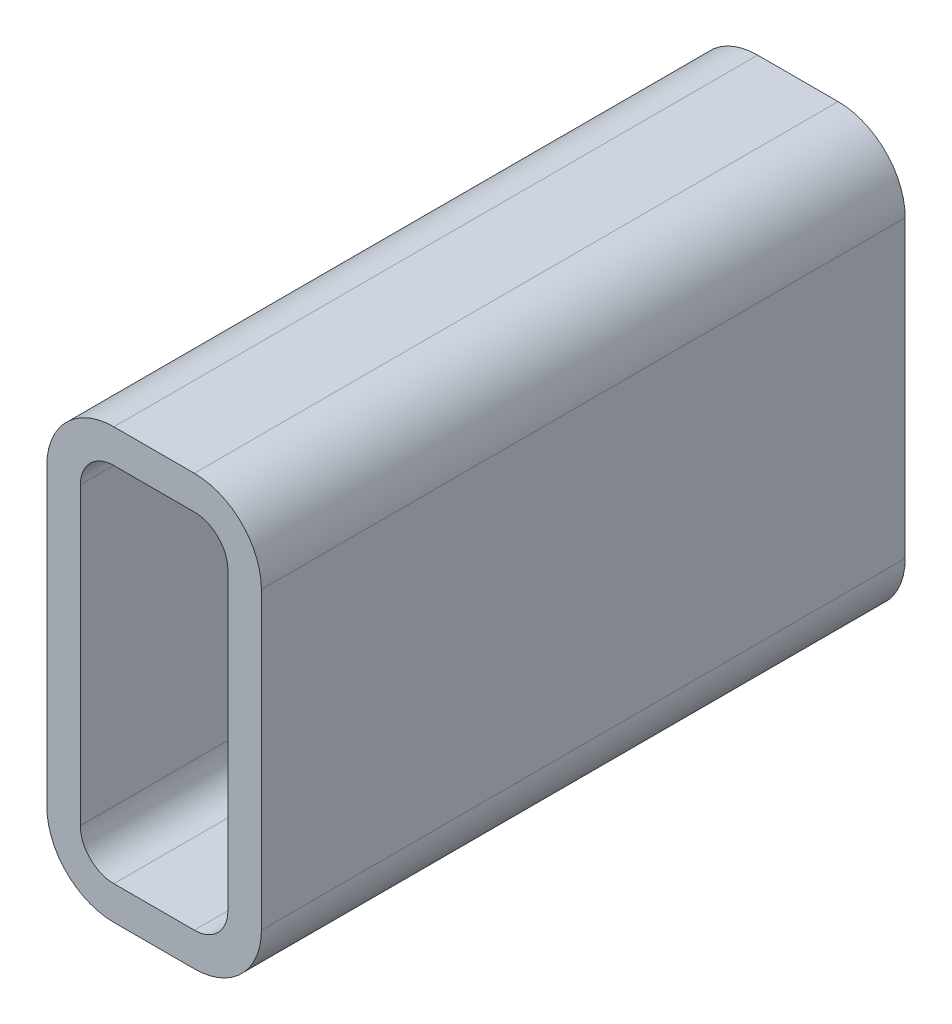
SolidWorks part; units mm, degrees
ref_plane "Front Plane" through (0, 0, 0) normal (0, 0, 1) x (1, 0, 0)
ref_plane "Top Plane" through (0, 0, 0) normal (0, 1, 0) x (1, 0, 0)
ref_plane "Right Plane" through (0, 0, 0) normal (1, 0, 0) x (0, 0, -1)
sketch "Sketch1" plane through (0, 0, 0) normal (0, 0, 1) x (1, 0, 0)
sketch_block_instance "HSS8x4x0.625-1"
sketch_block "HSS8x4x0.625"
extrude "Boss-Extrude1" add sketch "Sketch1" along normal blind 304.8
